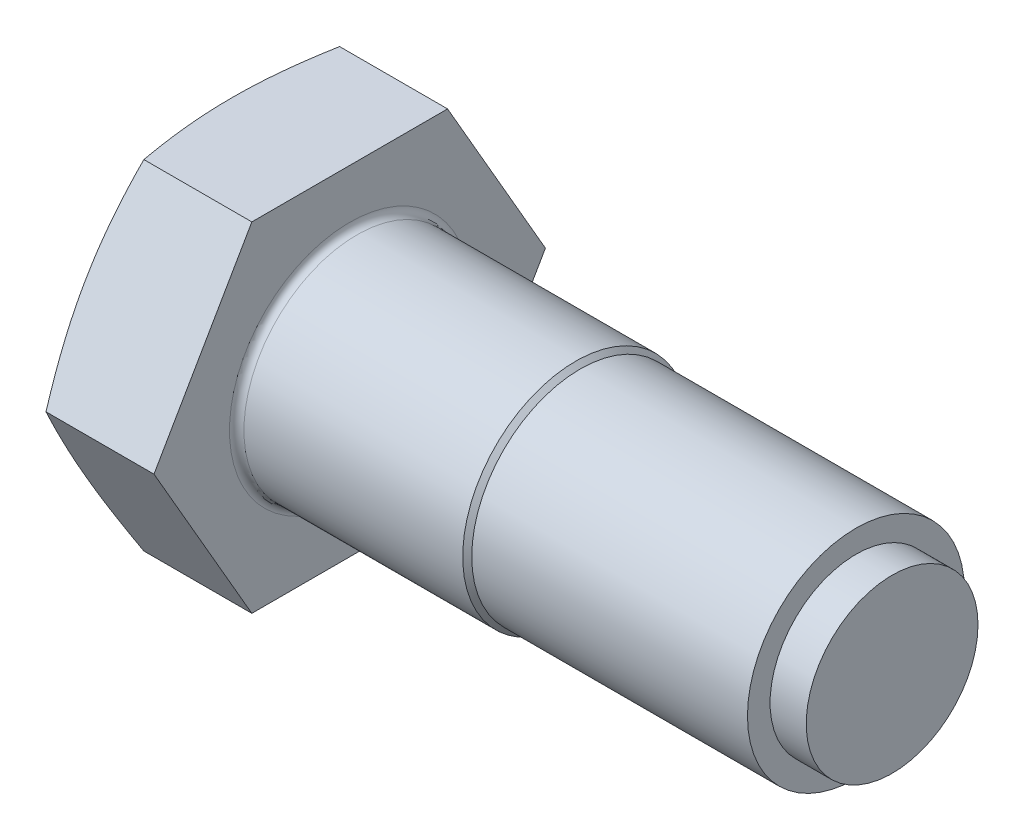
SolidWorks part; units mm, degrees
ref_plane "Front" through (0, 0, 0) normal (0, 0, 1) x (1, 0, 0)
ref_plane "Top" through (0, 0, 0) normal (0, 1, 0) x (1, 0, 0)
ref_plane "Right" through (0, 0, 0) normal (1, 0, 0) x (0, 0, -1)
sketch "Sketch1" plane through (0, 0, 0) normal (1, 0, 0) x (0, 0, -1)
  line L1 (43.3013, 0) -> (21.6506, 37.5)
  line L2 (21.6506, 37.5) -> (-21.6506, 37.5)
  line L3 (-21.6506, 37.5) -> (-43.3013, 0)
  line L4 (-43.3013, 0) -> (-21.6506, -37.5)
  line L5 (-21.6506, -37.5) -> (21.6506, -37.5)
  line L6 (21.6506, -37.5) -> (43.3013, 0)
  circle A0 centre (0, 0) radius 37.5 construction
  dimension "s" = 75
extrude "BaseHead" add sketch "Sketch1" along normal blind 26
sketch "Sketch2" plane through (26, 0, 0) normal (1, 0, 0) x (0, 0, -1)
  circle A0 centre (0, 0) radius 25
  dimension "ds" = 50
extrude "Basebody1" add sketch "Sketch2" along normal blind 50
sketch "Sketch4" plane through (76, 0, 0) normal (1, 0, 0) x (0, 0, -1)
  circle A0 centre (0, 0) radius 24
  dimension "d" = 48
extrude "Basebody2" add sketch "Sketch4" along normal offset from surface (70 mm away) 120
sketch "Sketch5" plane through (146, 0, 0) normal (1, 0, 0) x (0, 0, -1)
  circle A0 centre (0, 0) radius 19
  dimension "dp" = 38
extrude "Cut-Extrude1" cut sketch "Sketch5" against normal blind 8 flip side to cut
sketch "Sketch6" plane through (0, 0, 0) normal (0, 1, 0) x (1, 0, 0)
  line L0 (0, 43.3013) -> (2.1115, 43.3013)
  line L1 (2.1115, 43.3013) -> (0, 37.5)
  line L3 (0, 37.5) -> (0, 43.3013)
  line L4 (-1.5773, 0) -> (3.1205, 0) construction
  line L6 (26, 43.3013) -> (0, 43.3013) construction
  dimension "D1" = 20
  dimension "D2" = 75
revolve "HeadChamfer" cut sketch "Sketch6" angle 360 about L4
fillet "HeadFillet" radius 1.6 1 edges at (26, 0, -25)
chamfer "Chamfer1" distance 1 angle 45 1 edges at (76, 0, -24)
equation "\"D1@Chamfer1\" =  ( \"ds@Sketch2\" - \"d@Sketch4\" )  / 2"
equation "\"D2@Sketch6\" = \"s@Sketch1\""
